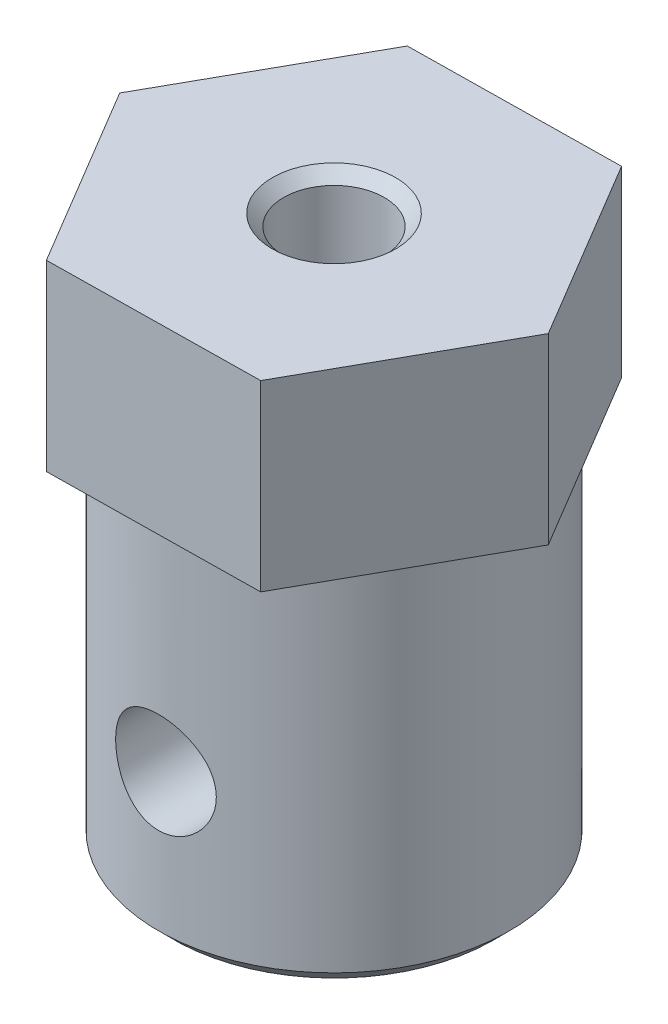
SolidWorks part; units mm, degrees
ref_plane "Alzado" through (0, 0, 0) normal (0, 0, 1) x (1, 0, 0)
ref_plane "Planta" through (0, 0, 0) normal (0, 1, 0) x (1, 0, 0)
ref_plane "Vista lateral" through (0, 0, 0) normal (1, 0, 0) x (0, 0, -1)
sketch "Croquis1" plane through (0, 0, 0) normal (0, 1, 0) x (1, 0, 0)
  line L1 (-3.5477, 5.951) -> (-6.9275, -0.0969)
  line L2 (-6.9275, -0.0969) -> (-3.3798, -6.0479)
  line L3 (-3.3798, -6.0479) -> (3.5477, -5.951)
  line L4 (3.5477, -5.951) -> (6.9275, 0.0969)
  line L5 (6.9275, 0.0969) -> (3.3798, 6.0479)
  line L6 (3.3798, 6.0479) -> (-3.5477, 5.951)
  circle A0 centre (0, 0) radius 6 construction
  dimension "D1" = 12
extrude "Saliente-Extruir1" add sketch "Croquis1" along normal blind 6
sketch "Croquis2" plane through (0, 6, 0) normal (0, 1, 0) x (1, 0, 0)
  point P0 (0, 0)
hole_wizard "Taladro roscado M41" positions "Croquis2" profile "Croquis3" tap size "M4" standard "DIN"
sketch "Croquis3" plane through (0, 6, 0) normal (1, 0, 0) x (0, 0, 1)
  line L0 (0, 0) -> (0, 6)
  line L1 (0, 6) -> (1.65, 6)
  line L2 (1.65, 6) -> (1.65, 0.375)
  line L3 (1.65, 0.375) -> (2.025, 0)
  line L5 (2.025, 0) -> (0, 0)
  line L6 (-1.65, 0.375) -> (-2.025, 0) construction
  line L11 (0, -6.35) -> (0, 107.95) construction
  dimension "Diámetro de perforador para roscar hasta el siguiente" = 3.3
  dimension "Profundidad de perforador para roscar hasta el siguiente" = 6
  dimension "Diámetro de avellanado cercano" = 4.05
  dimension "Ángulo de avellanado cercano" = 90
sketch "Croquis4" plane through (0, 0, 0) normal (0, -1, 0) x (1, 0, 0)
  circle A0 centre (0, 0) radius 3
  circle A1 centre (0, 0) radius 5.75
  dimension "D1" = 11.5
  dimension "D2" = 6
extrude "Saliente-Extruir2" add sketch "Croquis4" along normal blind 12
hole_wizard "Taladro roscado M42" positions "Croquis6" profile "Croquis7" tap size "M4" standard "DIN"
sketch "Croquis6" plane through (0, 0, 0) normal (0, 0, 1) x (1, 0, 0)
  line L0 (-5.75, -12) -> (5.75, -12) construction
  point P0 (0, -7)
  dimension "D1" = 5
sketch "Croquis7" plane through (0, -7, 0) normal (1, 0, 0) x (0, 1, 0)
  line L0 (0, 0) -> (0, 6.0479)
  line L1 (0, 6.0479) -> (1.65, 6.0479)
  line L2 (1.65, 6.0479) -> (1.65, 0.375)
  line L3 (1.65, 0.375) -> (2.025, 0)
  line L5 (2.025, 0) -> (0, 0)
  line L6 (-1.65, 0.375) -> (-2.025, 0) construction
  line L11 (0, -6.35) -> (0, 107.95) construction
  dimension "Diámetro de perforador para roscar hasta el siguiente" = 3.3
  dimension "Profundidad de perforador para roscar hasta el siguiente" = 6.0479
  dimension "Diámetro de avellanado cercano" = 4.05
  dimension "Ángulo de avellanado cercano" = 90
chamfer "Chaflán1" distance 0.5 angle 45 2 edges at (0, -12, -5.75) (0, -12, -3)
